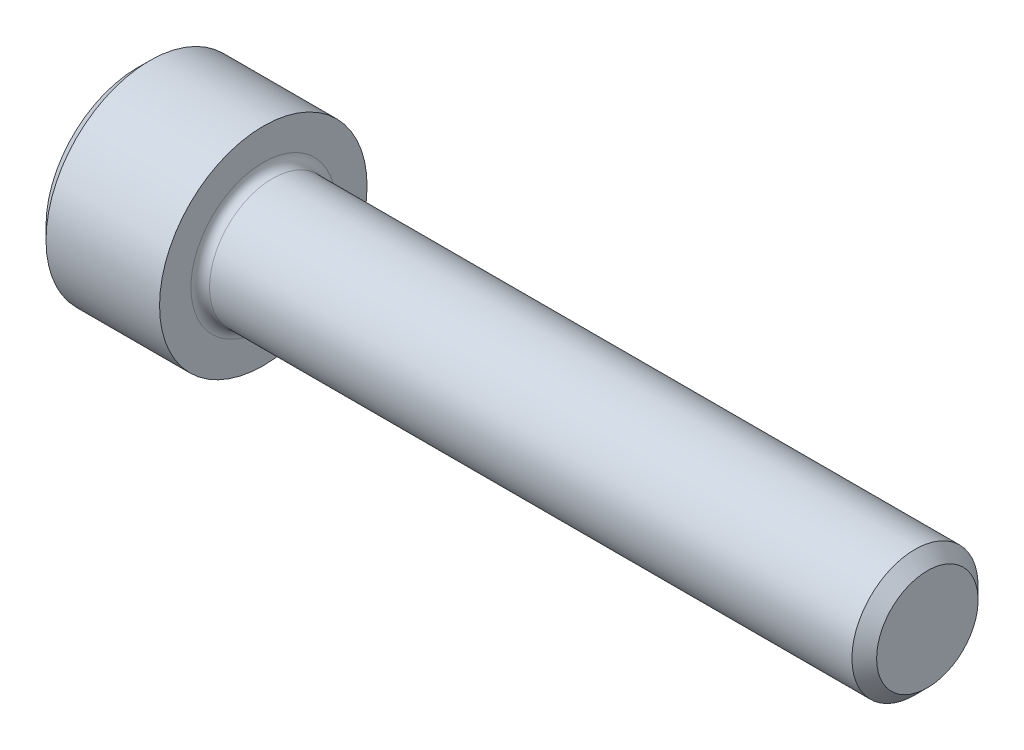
SolidWorks part; units mm, degrees
revolve "Base-Revolve" add sketch "BodySke"
sketch "BodySke" plane through (0, 0, 0) normal (0, 0, 1) x (1, 0, 0)
  line L0 (0, 0) -> (0, 3.4861)
  line L1 (0.4826, 3.9688) -> (4.826, 3.9688)
  line L2 (4.826, 3.9688) -> (4.826, 2.413)
  line L3 (4.826, 2.413) -> (29.7536, 2.413)
  line L4 (30.226, 1.9406) -> (30.226, 0)
  line L5 (30.226, 0) -> (0, 0)
  line L6 (-31.75, 0) -> (127, 0) construction
  line L7 (0, 3.4861) -> (0.4826, 3.9688)
  line L8 (30.226, 1.9406) -> (29.7536, 2.413)
  line L9 (0, -3.4861) -> (0.4826, -3.9688) construction
  line L10 (30.226, -1.9406) -> (29.7536, -2.413) construction
  line L11 (5.6185, 9.525) -> (5.6185, 3.175) construction
  line L12 (4.826, 9.525) -> (4.826, 3.175) construction
  line L13 (-7.874, 9.525) -> (-7.874, 3.175) construction
  dimension "Diameter" = 4.826
  dimension "Head_ht" = 4.826
  dimension "Length" = 25.4
  dimension "Body_ch_ang" = 45
  dimension "Head_dia" = 7.9375
  dimension "Head_ch_ang" = 45
  dimension "Head_side_ht" = 4.3434
  dimension "Minor_dia" = 3.8811
  dimension "Advance" = 0.7925
  dimension "Thread_nom" = 25.4
  dimension "Thread_length" = 38.1
fillet "Fillet1" radius 0.3556 1 edges at (4.826, 0, 2.413)
ref_plane "Plane1" through (0, 0, 0) normal (0, 0, 1) x (1, 0, 0)
ref_plane "Plane2" through (0, 0, 0) normal (0, 1, 0) x (1, 0, 0)
ref_plane "Plane3" through (0, 0, 0) normal (1, 0, 0) x (0, 0, -1)
sketch "Sketch2" plane through (0, 0, 0) normal (0, 0, 1) x (1, 0, 0)
  line L0 (0, 1.985) -> (2.286, 1.985)
  line L1 (2.286, 1.985) -> (3.432, 0)
  line L2 (-31.75, 0) -> (127, 0) construction
  line L3 (3.432, 0) -> (0, 0)
  line L4 (0, 0) -> (0, 1.985)
  line L5 (0, 3.4861) -> (0, -3.4861) construction
  line L6 (0, 0) -> (47.625, 0) construction
  line L7 (4.826, -3.9688) -> (4.826, 3.9688) construction
revolve "Hex-PreBroach" cut sketch "Sketch2" angle 360 about L6
sketch "Sketch3" plane through (0, 0, 0) normal (-1, 0, 0) x (0, 0.5, 0.866)
  line L0 (1.146, 1.985) -> (-1.146, 1.985)
  line L1 (-1.146, 1.985) -> (-2.2921, 0)
  line L2 (1.146, 1.985) -> (2.2921, 0)
  line L3 (1.146, -1.985) -> (2.2921, 0)
  line L4 (1.146, -1.985) -> (-1.146, -1.985)
  line L5 (-1.146, -1.985) -> (-2.2921, 0)
extrude "Hex" cut sketch "Sketch3" against normal blind 2.286
sketch "Sketch4" plane through (0, 0, 0) normal (-1, 0, 0) x (0, 0, 1)
  line L0 (0, 0) -> (2.3876, 0)
  line L1 (0, 0) -> (6.1484, 3.5498) construction
  line L2 (0, 0) -> (1.1938, 2.0677)
  line L3 (1.9883, 0.576) -> (2.2704, 0.7389)
  line L4 (1.493, 1.4339) -> (1.7751, 1.5968)
  arc A0 (1.9883, 0.576) -> (1.493, 1.4339) centre (0, 0) ccw
  arc A1 (2.3876, 0) -> (2.2704, 0.7389) centre (0, 0) ccw
  arc A2 (1.1938, 2.0677) -> (1.7751, 1.5968) centre (0, 0) cw
extrude "Spline" [suppressed] cut sketch "Sketch4" against normal blind 2.286
pattern_circular "CirPattern1" [suppressed] count 6 every 60
sketch "Sketch5" plane through (0, 0, 0) normal (0, 0, 1) x (1, 0, 0)
  line L0 (-31.75, 0) -> (127, 0) construction
  line L2 (0, 3.4861) -> (0, -3.4861) construction
  circle A0 centre (1.651, 0) radius 0.5905
  dimension "Drilled_hole_dia" = 1.1811
  dimension "Drilled_hole_loc" = 1.651
extrude "Hole" [suppressed] cut sketch "Sketch5" against normal through all and the other way through all
pattern_circular "Drilled-4" [suppressed] count 2 every 60
pattern_circular "Drilled-6" [suppressed] count 3 every 60
sketch "ThdSchSke" plane through (0, 0, 0) normal (0, 0, 1) x (1, 0, 0)
  line L0 (5.6185, -1.9406) -> (5.2877, -2.413)
  line L1 (5.6185, -1.9406) -> (5.9493, -2.413)
  line L2 (5.9493, -2.413) -> (5.9493, -3.0163)
  line L3 (-3.175, 0) -> (5.1513, 0) construction
  line L5 (5.9493, -3.0163) -> (5.2877, -3.0162)
  line L6 (5.2877, -3.0162) -> (5.2877, -2.413)
  line L7 (0, 3.4861) -> (0, -3.4861) construction
revolve "ThreadSchematic" [suppressed] cut sketch "ThdSchSke" angle 360 about L3
pattern_linear "ThdSchPat" [suppressed]
equation "\"D2@Sketch3\" = \"Hex_size@Sketch3\" / 2"
equation "\"D1@Sketch3\" = \"Hex_size@Sketch3\" / 2"
equation "\"D1@Sketch2\" = \"Hex_size@Sketch3\" / 2"
equation "\"D3@Sketch4\" = \"Spline_p_dim@Sketch4\" / 2"
equation "\"Thread_minor@ThreadCosmetic\"  =  \"Minor_dia@BodySke\""
equation "\"D2@CirPattern1\" = 360 / \"Num_teeth@CirPattern1\""
equation "\"Wall_thickness@Sketch2\" = \"Head_ht@BodySke\" - \"Key_eng@Hex\""
equation "\"Thread_length@ThreadCosmetic\" = ((sgn( (\"Length@BodySke\" - \"Advance@BodySke\" ) - \"Thread_nom@BodySke\" )-1)*( (\"Length@BodySke\" - \"Advance@BodySke\" ) - \"Thread_nom@BodySke\" ))/-2+ \"Thread_nom@BodySke\""
equation "\"Thread_minor@ThdSchSke\" = \"Minor_dia@BodySke\""
equation "\"Diameter@ThdSchSke\" = \"Diameter@BodySke\""
equation "\"Overcut@ThdSchSke\" = \"Diameter@BodySke\" * 1.25"
equation "\"Start@ThdSchSke\" = \"Head_ht@BodySke\" + \"Length@BodySke\" - \"Thread_length@ThreadCosmetic\"  '---Non-countersunk---"
equation "\"Num_threads@ThdSchPat\" = int( \"Thread_length@ThreadCosmetic\" / \"Advance@BodySke\" + 0.999 )  + 1"
equation "\"Advance@ThdSchPat\" = \"Thread_length@ThreadCosmetic\" /  (\"Num_threads@ThdSchPat\" - 1) 'relax it"
equation "\"Num_threads@ThdSchPat\" = \"Num_threads@ThdSchPat\" - sgn( \"Num_threads@ThdSchPat\" - 1) '---chamfered tips only---"
